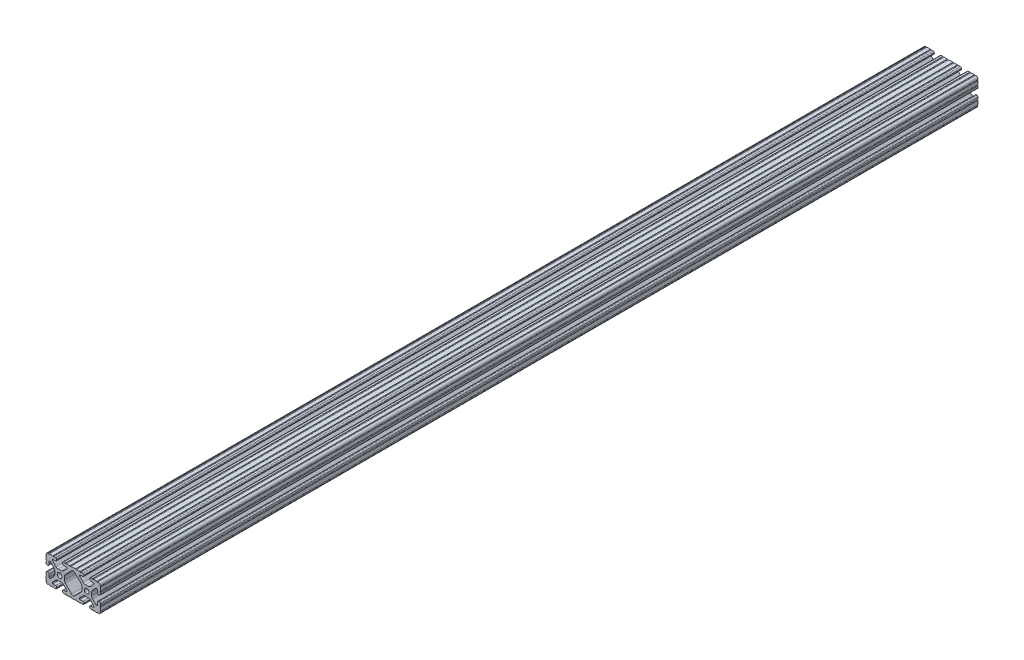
SolidWorks part; units mm, degrees
ref_plane "Front" through (0, 0, 0) normal (0, 0, 1) x (1, 0, 0)
ref_plane "Top" through (0, 0, 0) normal (0, 1, 0) x (1, 0, 0)
ref_plane "Right" through (0, 0, 0) normal (1, 0, 0) x (0, 0, -1)
sketch "Sketch1" plane through (0, 0, 0) normal (0, 0, 1) x (1, 0, 0)
  line L2 (30.3513, 26.5282) -> (39.1767, 35.3536)
  line L3 (40.5679, 38.7122) -> (40.5679, 42.8592)
  line L4 (39.1767, 46.2178) -> (30.3513, 55.0433)
  line L5 (26.1972, 55.0433) -> (17.3719, 46.2178)
  line L6 (15.9807, 42.8592) -> (15.9807, 38.7122)
  line L7 (17.3719, 35.3536) -> (26.1972, 26.5282)
  line L8 (37.19, 54.3201) -> (37.19, 54.8827)
  line L9 (38.079, 55.7717) -> (41.6855, 55.7717)
  line L10 (43.2603, 57.3465) -> (43.2603, 58.2825)
  line L11 (41.707, 59.8357) -> (39.2718, 59.8357)
  line L12 (37.7478, 59.8357) -> (32.9194, 59.8357)
  line L13 (31.3954, 59.8357) -> (25.1532, 59.8357)
  line L14 (23.6292, 59.8357) -> (18.8007, 59.8357)
  line L15 (17.2767, 59.8357) -> (14.8415, 59.8357)
  line L16 (13.2883, 58.2825) -> (13.2883, 57.3465)
  line L17 (14.8631, 55.7717) -> (18.4695, 55.7717)
  line L18 (19.3585, 54.8827) -> (19.3585, 54.3201)
  line L19 (19.0981, 53.6915) -> (14.4218, 49.0151)
  line L20 (11.0632, 47.6239) -> (7.3854, 47.6239)
  line L21 (4.0268, 49.0151) -> (-0.6496, 53.6915)
  line L22 (-0.91, 54.3201) -> (-0.91, 54.8827)
  line L23 (-0.021, 55.7717) -> (3.5855, 55.7717)
  line L24 (5.1603, 57.3465) -> (5.1603, 58.2663)
  line L25 (3.7154, 59.8357) -> (1.3285, 59.8357)
  line L26 (-0.1955, 59.8357) -> (-5.022, 59.8357)
  line L27 (-9.8257, 55.1609) -> (-9.8257, 50.3354)
  line L28 (-9.8257, 48.8114) -> (-9.8257, 46.4245)
  line L29 (-8.2509, 44.8497) -> (-7.3365, 44.8497)
  line L30 (-5.7617, 46.4245) -> (-5.7617, 50.1837)
  line L31 (-4.8727, 51.0727) -> (-4.1464, 51.0727)
  line L32 (-3.5178, 50.8123) -> (1.0767, 46.2178)
  line L33 (2.4679, 42.8592) -> (2.4679, 38.7122)
  line L34 (1.0767, 35.3536) -> (-3.5178, 30.7591)
  line L35 (-4.1464, 30.4987) -> (-4.8727, 30.4987)
  line L36 (-5.7617, 31.3877) -> (-5.7617, 35.1469)
  line L37 (-7.3365, 36.7217) -> (-8.2509, 36.7217)
  line L38 (-9.8257, 35.1469) -> (-9.8257, 32.76)
  line L39 (-9.8257, 31.236) -> (-9.8257, 25.7497)
  line L40 (-5.773, 21.7357) -> (-0.1955, 21.7357)
  line L41 (1.3285, 21.7357) -> (3.5855, 21.7357)
  line L42 (5.1603, 23.3105) -> (5.1603, 24.2249)
  line L43 (3.5855, 25.7997) -> (-0.1737, 25.7997)
  line L44 (-1.0627, 26.6887) -> (-1.0627, 27.0985)
  line L45 (-0.8023, 27.7272) -> (4.0268, 32.5563)
  line L46 (7.3854, 33.9475) -> (11.0632, 33.9475)
  line L47 (14.4218, 32.5563) -> (19.2509, 27.7272)
  line L48 (19.5113, 27.0985) -> (19.5113, 26.6887)
  line L49 (18.6223, 25.7997) -> (14.8631, 25.7997)
  line L50 (13.2883, 24.2249) -> (13.2883, 23.3105)
  line L51 (14.8631, 21.7357) -> (17.2767, 21.7357)
  line L52 (18.8007, 21.7357) -> (23.6292, 21.7357)
  line L53 (25.1532, 21.7357) -> (31.3954, 21.7357)
  line L54 (32.9194, 21.7357) -> (37.7478, 21.7357)
  line L55 (39.2718, 21.7357) -> (41.6855, 21.7357)
  line L56 (43.2603, 23.3105) -> (43.2603, 24.2249)
  line L57 (41.6855, 25.7997) -> (37.9263, 25.7997)
  line L58 (37.0373, 26.6887) -> (37.0373, 27.0985)
  line L59 (37.2977, 27.7272) -> (42.1268, 32.5563)
  line L60 (45.4854, 33.9475) -> (49.1632, 33.9475)
  line L61 (52.5218, 32.5563) -> (57.3509, 27.7272)
  line L62 (57.6113, 27.0985) -> (57.6113, 26.6887)
  line L63 (56.7223, 25.7997) -> (52.9631, 25.7997)
  line L64 (51.3883, 24.2249) -> (51.3883, 23.3105)
  line L65 (52.9631, 21.7357) -> (55.2201, 21.7357)
  line L66 (56.7441, 21.7357) -> (62.3216, 21.7357)
  line L67 (66.3743, 25.7497) -> (66.3743, 31.236)
  line L68 (66.3743, 32.76) -> (66.3743, 35.1469)
  line L69 (64.7995, 36.7217) -> (63.8851, 36.7217)
  line L70 (62.3103, 35.1469) -> (62.3103, 31.3877)
  line L71 (61.4213, 30.4987) -> (60.6949, 30.4987)
  line L72 (60.0663, 30.7591) -> (55.4719, 35.3536)
  line L73 (54.0807, 38.7122) -> (54.0807, 42.8592)
  line L74 (55.4719, 46.2178) -> (60.0663, 50.8123)
  line L75 (60.6949, 51.0727) -> (61.4213, 51.0727)
  line L76 (62.3103, 50.1837) -> (62.3103, 46.4245)
  line L77 (63.8851, 44.8497) -> (64.7995, 44.8497)
  line L78 (66.3743, 46.4245) -> (66.3743, 48.8114)
  line L79 (66.3743, 50.3354) -> (66.3743, 55.1609)
  line L80 (61.5705, 59.8357) -> (56.7441, 59.8357)
  line L81 (55.2201, 59.8357) -> (52.8332, 59.8357)
  line L82 (51.3883, 58.2663) -> (51.3883, 57.3465)
  line L83 (52.9631, 55.7717) -> (56.5695, 55.7717)
  line L84 (57.4585, 54.8827) -> (57.4585, 54.3201)
  line L85 (57.1981, 53.6915) -> (52.5218, 49.0151)
  line L86 (49.1632, 47.6239) -> (45.4854, 47.6239)
  line L87 (42.1268, 49.0151) -> (37.4504, 53.6915)
  arc A0 (39.1767, 35.3536) -> (40.5679, 38.7122) centre (35.8181, 38.7122) ccw
  arc A1 (30.3513, 55.0433) -> (28.2743, 55.8988) centre (28.2858, 52.9778) ccw
  arc A2 (28.2743, 55.8988) -> (26.1972, 55.0433) centre (28.2627, 52.9778) ccw
  arc A3 (17.3719, 46.2178) -> (15.9807, 42.8592) centre (20.7305, 42.8592) ccw
  arc A4 (15.9807, 38.7122) -> (17.3719, 35.3536) centre (20.7305, 38.7122) ccw
  arc A5 (26.1972, 26.5282) -> (28.2743, 25.6726) centre (28.2627, 28.5936) ccw
  arc A6 (28.2743, 25.6726) -> (30.3513, 26.5282) centre (28.2858, 28.5936) ccw
  circle A7 centre (47.3243, 40.7857) radius 3.3274
  circle A8 centre (9.2243, 40.7857) radius 3.3274
  arc A9 (40.5679, 42.8592) -> (39.1767, 46.2178) centre (35.8181, 42.8592) ccw
  arc A10 (38.079, 55.7717) -> (37.19, 54.8827) centre (38.079, 54.8827) ccw
  arc A11 (41.6855, 55.7717) -> (43.2603, 57.3465) centre (41.6855, 57.3465) ccw
  arc A12 (43.2603, 58.2825) -> (41.707, 59.8357) centre (41.707, 58.2825) ccw
  arc A13 (37.7478, 59.8357) -> (39.2718, 59.8357) centre (38.5098, 59.8357) ccw
  arc A14 (31.3954, 59.8357) -> (32.9194, 59.8357) centre (32.1574, 59.8357) ccw
  arc A15 (23.6292, 59.8357) -> (25.1532, 59.8357) centre (24.3912, 59.8357) ccw
  arc A16 (17.2767, 59.8357) -> (18.8007, 59.8357) centre (18.0387, 59.8357) ccw
  arc A17 (14.8415, 59.8357) -> (13.2883, 58.2825) centre (14.8415, 58.2825) ccw
  arc A18 (13.2883, 57.3465) -> (14.8631, 55.7717) centre (14.8631, 57.3465) ccw
  arc A19 (19.3585, 54.8827) -> (18.4695, 55.7717) centre (18.4695, 54.8827) ccw
  arc A20 (19.0981, 53.6915) -> (19.3585, 54.3201) centre (18.4695, 54.3201) ccw
  arc A21 (11.0632, 47.6239) -> (14.4218, 49.0151) centre (11.0632, 52.3737) ccw
  arc A22 (4.0268, 49.0151) -> (7.3854, 47.6239) centre (7.3854, 52.3737) ccw
  arc A23 (-0.91, 54.3201) -> (-0.6496, 53.6915) centre (-0.021, 54.3201) ccw
  arc A24 (-0.021, 55.7717) -> (-0.91, 54.8827) centre (-0.021, 54.8827) ccw
  arc A25 (3.5855, 55.7717) -> (5.1603, 57.3465) centre (3.5855, 57.3465) ccw
  arc A26 (5.1603, 58.2663) -> (3.7154, 59.8357) centre (3.5855, 58.2663) ccw
  arc A27 (-0.1955, 59.8357) -> (1.3285, 59.8357) centre (0.5665, 59.8357) ccw
  arc A28 (-6.5453, 59.8825) -> (-5.022, 59.8357) centre (-5.7836, 59.8591) ccw
  arc A29 (-6.5453, 59.8825) -> (-9.8633, 56.684) centre (-6.6287, 56.6488) ccw
  arc A30 (-9.8257, 55.1609) -> (-9.8633, 56.684) centre (-9.8257, 55.9229) ccw
  arc A31 (-9.8257, 48.8114) -> (-9.8257, 50.3354) centre (-9.8257, 49.5734) ccw
  arc A32 (-9.8257, 46.4245) -> (-8.2509, 44.8497) centre (-8.2509, 46.4245) ccw
  arc A33 (-7.3365, 44.8497) -> (-5.7617, 46.4245) centre (-7.3365, 46.4245) ccw
  arc A34 (-4.8727, 51.0727) -> (-5.7617, 50.1837) centre (-4.8727, 50.1837) ccw
  arc A35 (-3.5178, 50.8123) -> (-4.1464, 51.0727) centre (-4.1464, 50.1837) ccw
  arc A36 (2.4679, 42.8592) -> (1.0767, 46.2178) centre (-2.2819, 42.8592) ccw
  arc A37 (1.0767, 35.3536) -> (2.4679, 38.7122) centre (-2.2819, 38.7122) ccw
  arc A38 (-4.1464, 30.4987) -> (-3.5178, 30.7591) centre (-4.1464, 31.3877) ccw
  arc A39 (-5.7617, 31.3877) -> (-4.8727, 30.4987) centre (-4.8727, 31.3877) ccw
  arc A40 (-5.7617, 35.1469) -> (-7.3365, 36.7217) centre (-7.3365, 35.1469) ccw
  arc A41 (-8.2509, 36.7217) -> (-9.8257, 35.1469) centre (-8.2509, 35.1469) ccw
  arc A42 (-9.8257, 31.236) -> (-9.8257, 32.76) centre (-9.8257, 31.998) ccw
  arc A43 (-9.8257, 24.2257) -> (-9.8257, 25.7497) centre (-9.8257, 24.9877) ccw
  arc A44 (-9.8257, 24.2257) -> (-7.297, 21.7357) centre (-6.6712, 24.9002) ccw
  arc A45 (-5.773, 21.7357) -> (-7.297, 21.7357) centre (-6.535, 21.7357) ccw
  arc A46 (1.3285, 21.7357) -> (-0.1955, 21.7357) centre (0.5665, 21.7357) ccw
  arc A47 (3.5855, 21.7357) -> (5.1603, 23.3105) centre (3.5855, 23.3105) ccw
  arc A48 (5.1603, 24.2249) -> (3.5855, 25.7997) centre (3.5855, 24.2249) ccw
  arc A49 (-1.0627, 26.6887) -> (-0.1737, 25.7997) centre (-0.1737, 26.6887) ccw
  arc A50 (-0.8023, 27.7272) -> (-1.0627, 27.0985) centre (-0.1737, 27.0985) ccw
  arc A51 (7.3854, 33.9475) -> (4.0268, 32.5563) centre (7.3854, 29.1977) ccw
  arc A52 (14.4218, 32.5563) -> (11.0632, 33.9475) centre (11.0632, 29.1977) ccw
  arc A53 (19.5113, 27.0985) -> (19.2509, 27.7272) centre (18.6223, 27.0985) ccw
  arc A54 (18.6223, 25.7997) -> (19.5113, 26.6887) centre (18.6223, 26.6887) ccw
  arc A55 (14.8631, 25.7997) -> (13.2883, 24.2249) centre (14.8631, 24.2249) ccw
  arc A56 (13.2883, 23.3105) -> (14.8631, 21.7357) centre (14.8631, 23.3105) ccw
  arc A57 (18.8007, 21.7357) -> (17.2767, 21.7357) centre (18.0387, 21.7357) ccw
  arc A58 (25.1532, 21.7357) -> (23.6292, 21.7357) centre (24.3912, 21.7357) ccw
  arc A59 (32.9194, 21.7357) -> (31.3954, 21.7357) centre (32.1574, 21.7357) ccw
  arc A60 (39.2718, 21.7357) -> (37.7478, 21.7357) centre (38.5098, 21.7357) ccw
  arc A61 (41.6855, 21.7357) -> (43.2603, 23.3105) centre (41.6855, 23.3105) ccw
  arc A62 (43.2603, 24.2249) -> (41.6855, 25.7997) centre (41.6855, 24.2249) ccw
  arc A63 (37.0373, 26.6887) -> (37.9263, 25.7997) centre (37.9263, 26.6887) ccw
  arc A64 (37.2977, 27.7272) -> (37.0373, 27.0985) centre (37.9263, 27.0985) ccw
  arc A65 (45.4854, 33.9475) -> (42.1268, 32.5563) centre (45.4854, 29.1977) ccw
  arc A66 (52.5218, 32.5563) -> (49.1632, 33.9475) centre (49.1632, 29.1977) ccw
  arc A67 (57.6113, 27.0985) -> (57.3509, 27.7272) centre (56.7223, 27.0985) ccw
  arc A68 (56.7223, 25.7997) -> (57.6113, 26.6887) centre (56.7223, 26.6887) ccw
  arc A69 (52.9631, 25.7997) -> (51.3883, 24.2249) centre (52.9631, 24.2249) ccw
  arc A70 (51.3883, 23.3105) -> (52.9631, 21.7357) centre (52.9631, 23.3105) ccw
  arc A71 (56.7441, 21.7357) -> (55.2201, 21.7357) centre (55.9821, 21.7357) ccw
  arc A72 (63.8456, 21.7357) -> (62.3216, 21.7357) centre (63.0836, 21.7357) ccw
  arc A73 (63.8456, 21.7357) -> (66.3743, 24.2257) centre (63.2122, 24.9079) ccw
  arc A74 (66.3743, 25.7497) -> (66.3743, 24.2257) centre (66.3743, 24.9877) ccw
  arc A75 (66.3743, 32.76) -> (66.3743, 31.236) centre (66.3743, 31.998) ccw
  arc A76 (66.3743, 35.1469) -> (64.7995, 36.7217) centre (64.7995, 35.1469) ccw
  arc A77 (63.8851, 36.7217) -> (62.3103, 35.1469) centre (63.8851, 35.1469) ccw
  arc A78 (61.4213, 30.4987) -> (62.3103, 31.3877) centre (61.4213, 31.3877) ccw
  arc A79 (60.0663, 30.7591) -> (60.6949, 30.4987) centre (60.6949, 31.3877) ccw
  arc A80 (54.0807, 38.7122) -> (55.4719, 35.3536) centre (58.8305, 38.7122) ccw
  arc A81 (55.4719, 46.2178) -> (54.0807, 42.8592) centre (58.8305, 42.8592) ccw
  arc A82 (60.6949, 51.0727) -> (60.0663, 50.8123) centre (60.6949, 50.1837) ccw
  arc A83 (62.3103, 50.1837) -> (61.4213, 51.0727) centre (61.4213, 50.1837) ccw
  arc A84 (62.3103, 46.4245) -> (63.8851, 44.8497) centre (63.8851, 46.4245) ccw
  arc A85 (64.7995, 44.8497) -> (66.3743, 46.4245) centre (64.7995, 46.4245) ccw
  arc A86 (66.3743, 50.3354) -> (66.3743, 48.8114) centre (66.3743, 49.5734) ccw
  arc A87 (66.4119, 56.684) -> (66.3743, 55.1609) centre (66.3743, 55.9229) ccw
  arc A88 (66.4119, 56.684) -> (63.0938, 59.8825) centre (63.1773, 56.6488) ccw
  arc A89 (61.5705, 59.8357) -> (63.0938, 59.8825) centre (62.3322, 59.8591) ccw
  arc A90 (55.2201, 59.8357) -> (56.7441, 59.8357) centre (55.9821, 59.8357) ccw
  arc A91 (52.8332, 59.8357) -> (51.3883, 58.2663) centre (52.9631, 58.2663) ccw
  arc A92 (51.3883, 57.3465) -> (52.9631, 55.7717) centre (52.9631, 57.3465) ccw
  arc A93 (57.4585, 54.8827) -> (56.5695, 55.7717) centre (56.5695, 54.8827) ccw
  arc A94 (57.1981, 53.6915) -> (57.4585, 54.3201) centre (56.5695, 54.3201) ccw
  arc A95 (49.1632, 47.6239) -> (52.5218, 49.0151) centre (49.1632, 52.3737) ccw
  arc A96 (42.1268, 49.0151) -> (45.4854, 47.6239) centre (45.4854, 52.3737) ccw
  arc A97 (37.19, 54.3201) -> (37.4504, 53.6915) centre (38.079, 54.3201) ccw
extrude "Extrude1" add sketch "Sketch1" along normal blind 1230.3125
sketch "Sketch2" plane through (0, 21.7357, 0) normal (0, -1, 0) x (1, 0, 0)
  line L0 (7.3854, 1230.3125) -> (11.0632, 1230.3125) construction
  line L1 (-9.8257, 1230.3125) -> (-9.8257, 0) construction
  line L2 (45.4854, 1230.3125) -> (49.1632, 1230.3125) construction
  line L4 (66.3743, 1230.3125) -> (66.3743, 0) construction
  circle A0 centre (9.2243, 1147.7625) radius 3.5719
  circle A1 centre (47.3243, 1147.7625) radius 3.5719
  circle A2 centre (47.3243, 792.1625) radius 3.5719
  circle A3 centre (47.3243, 754.0625) radius 3.5719
  circle A4 centre (9.2243, 42.8625) radius 3.5719
  circle A5 centre (47.3243, 42.8625) radius 3.5719
  point P2 (9.2243, 1230.3125)
  point P9 (47.3243, 1230.3125)
  dimension "D1" = 7.1437
  dimension "D2" = 82.55
  dimension "D4" = 38.1
  dimension "D5" = 7.1437
  dimension "D8" = 19.05
  dimension "D15" = 7.1437
  dimension "D16" = 7.1437
  dimension "D17" = 7.1437
  dimension "D18" = 7.1437
  dimension "D3" = 19.05
  dimension "D6" = 82.55
  dimension "D7" = 1104.9
  dimension "D9" = 19.05
  dimension "D10" = 38.1
  dimension "D11" = 19.05
  dimension "D12" = 38.1
  dimension "D13" = 355.6
  dimension "D14" = 711.2
extrude "Extrude2" cut sketch "Sketch2" against normal blind 38.1
